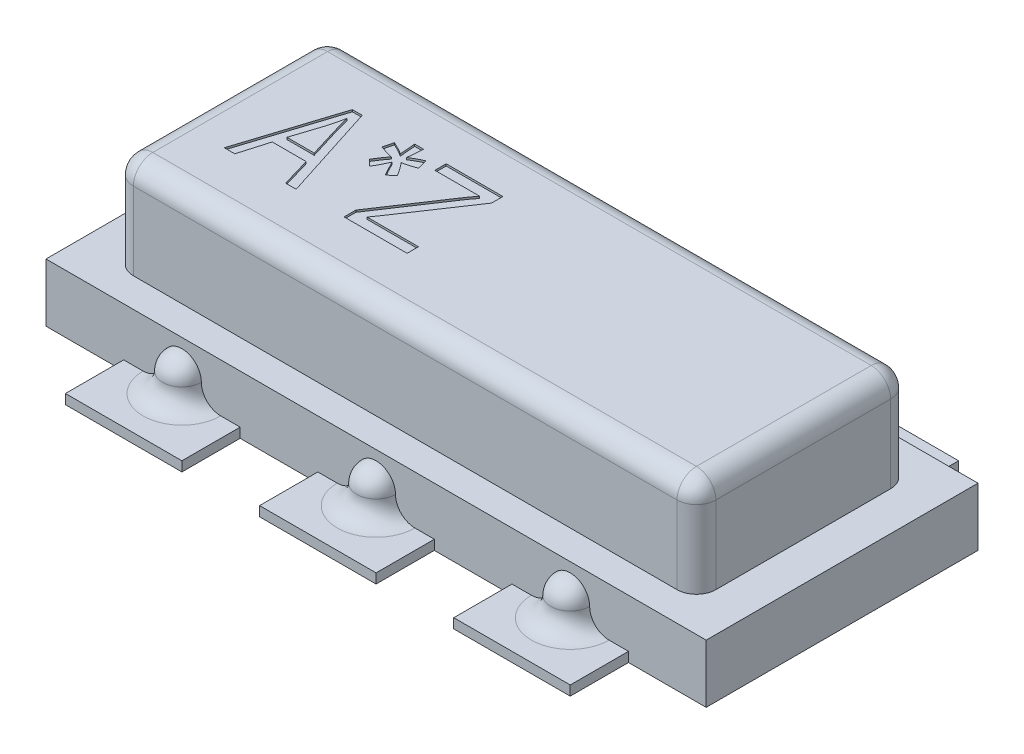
SolidWorks part; units mm, degrees
ref_plane "Plan de face" through (0, 0, 0) normal (0, 0, 1) x (1, 0, 0)
ref_plane "Plan de dessus" through (0, 0, 0) normal (0, 1, 0) x (1, 0, 0)
ref_plane "Plan de droite" through (0, 0, 0) normal (1, 0, 0) x (0, 0, -1)
sketch "Esquisse1" plane through (0, 0, 0) normal (0, 1, 0) x (1, 0, 0)
  line L1 (-1.7, -0.7) -> (1.7, -0.7)
  line L2 (-1.7, -0.7) -> (-1.7, 0.7)
  line L3 (-1.7, 0.7) -> (1.7, 0.7)
  line L4 (1.7, -0.7) -> (1.7, 0.7)
  point P4 (0, -0.7)
  point P6 (-1.7, 0)
  dimension "D1" = 3.4
  dimension "D2" = 1.4
extrude "Boss.-Extru.1" add sketch "Esquisse1" along normal blind 0.3
sketch "Esquisse2" plane through (0, 0.3, 0) normal (0, 1, 0) x (1, 0, 0)
  line L1 (-1.5, 0.55) -> (1.5, 0.55)
  line L2 (-1.5, 0.55) -> (-1.5, -0.55)
  line L3 (-1.5, -0.55) -> (1.5, -0.55)
  line L4 (1.5, 0.55) -> (1.5, -0.55)
  point P4 (-1.5, 0)
  point P6 (0, -0.55)
  dimension "D1" = 3
  dimension "D2" = 1.1
extrude "Boss.-Extru.2" add sketch "Esquisse2" along normal blind 0.5 separate body
fillet "Congé1" radius 0.1 8 edges at (-1.5, 0.8, 0) (0, 0.8, -0.55) (1.5, 0.8, 0) (0, 0.8, 0.55) (-1.5, 0.55, -0.55) (1.5, 0.55, -0.55) (1.5, 0.55, 0.55) (-1.5, 0.55, 0.55)
sketch "Esquisse3" plane through (0, 0, 0) normal (0, 1, 0) x (1, 0, 0)
  line L0 (-1.7, -0.7) -> (1.7, -0.7) construction
  line L1 (-1.3, -0.7) -> (-0.7, -0.7)
  line L2 (-1.3, -0.7) -> (-1.3, -1)
  line L3 (-1.3, -1) -> (-0.7, -1)
  line L4 (-0.7, -0.7) -> (-0.7, -1)
  line L5 (1.7, 0.7) -> (-1.7, 0.7) construction
  line L6 (-0.3, -0.7) -> (0.3, -0.7)
  line L7 (-0.3, -0.7) -> (-0.3, -1)
  line L8 (-0.3, -1) -> (0.3, -1)
  line L9 (0.3, -0.7) -> (0.3, -1)
  line L10 (0.7, -0.7) -> (1.3, -0.7)
  line L11 (0.7, -0.7) -> (0.7, -1)
  line L12 (0.7, -1) -> (1.3, -1)
  line L13 (1.3, -0.7) -> (1.3, -1)
  line L14 (1.3, 0.7) -> (0.7, 0.7)
  line L15 (1.3, 0.7) -> (1.3, 1)
  line L16 (1.3, 1) -> (0.7, 1)
  line L17 (0.7, 0.7) -> (0.7, 1)
  line L19 (0.3, 0.7) -> (-0.3, 0.7)
  line L20 (0.3, 0.7) -> (0.3, 1)
  line L21 (0.3, 1) -> (-0.3, 1)
  line L22 (-0.3, 0.7) -> (-0.3, 1)
  line L23 (-0.7, 0.7) -> (-1.3, 0.7)
  line L24 (-0.7, 0.7) -> (-0.7, 1)
  line L25 (-0.7, 1) -> (-1.3, 1)
  line L26 (-1.3, 0.7) -> (-1.3, 1)
  point P28 (0, -1)
  dimension "D1" = 0.6
  dimension "D2" = 0.3
  dimension "D3" = 0.4
  dimension "D4" = 0.4
extrude "Boss.-Extru.3" add sketch "Esquisse3" along normal blind 0.05 separate body
sketch "Esquisse4" plane through (0, 0.05, 0) normal (0, 1, 0) x (1, 0, 0)
  line L0 (-1.3, 0.7) -> (-0.7, 0.7) construction
  line L1 (1.7, 0.7) -> (-1.7, 0.7) construction
  line L2 (0.7, 0.7) -> (1.3, 0.7) construction
  line L3 (-1.7, -0.7) -> (1.7, -0.7) construction
  line L4 (0.3, -0.7) -> (-0.3, -0.7) construction
  line L5 (1.3, -0.7) -> (0.7, -0.7) construction
  line L6 (-1.1, 0.7) -> (-0.9, 0.7)
  line L7 (-0.1, 0.7) -> (0.1, 0.7)
  line L8 (0.9, 0.7) -> (1.1, 0.7)
  line L9 (-1.1, -0.7) -> (-0.9, -0.7)
  line L10 (-0.1, -0.7) -> (0.1, -0.7)
  line L11 (0.9, -0.7) -> (1.1, -0.7)
  arc A0 (-1.1, 0.7) -> (-0.9, 0.7) centre (-1, 0.7) cw
  arc A1 (-0.1, 0.7) -> (0.1, 0.7) centre (0, 0.7) cw
  arc A2 (0.9, 0.7) -> (1.1, 0.7) centre (1, 0.7) cw
  arc A3 (-0.9, -0.7) -> (-1.1, -0.7) centre (-1, -0.7) cw
  arc A4 (-0.1, -0.7) -> (0.1, -0.7) centre (0, -0.7) ccw
  arc A5 (0.9, -0.7) -> (1.1, -0.7) centre (1, -0.7) ccw
  dimension "D1" = 0.1
extrude "Boss.-Extru.4" add sketch "Esquisse4" along normal blind 0.2
fillet "Congé2" radius 0.1 1 edges at (-1, 0.25, 0.8)
fillet "Congé3" radius 0.1 1 edges at (0, 0.25, 0.8)
fillet "Congé4" radius 0.1 1 edges at (1, 0.25, 0.8)
fillet "Congé5" radius 0.1 1 edges at (1, 0.25, -0.8)
fillet "Congé6" radius 0.1 1 edges at (0, 0.25, -0.8)
fillet "Congé7" radius 0.1 1 edges at (-1, 0.25, -0.8)
fillet "Congé11" radius 0.1 6 edges at (1, 0.05, -0.8) (1, 0.05, 0.8) (0, 0.05, 0.8) (-1, 0.05, 0.8) (-1, 0.05, -0.8) (0, 0.05, -0.8)
sketch "Esquisse5" plane through (0, 0.8, 0) normal (0, 1, 0) x (1, 0, 0)
  line L0 (-1.237, -0.2448) -> (0.5678, -0.2448) construction
  text T0 "A*Z" font "Arial Narrow" height 0.5
extrude "Enlèv. mat.-Extru.1" cut sketch "Esquisse5" against normal blind 0.01
